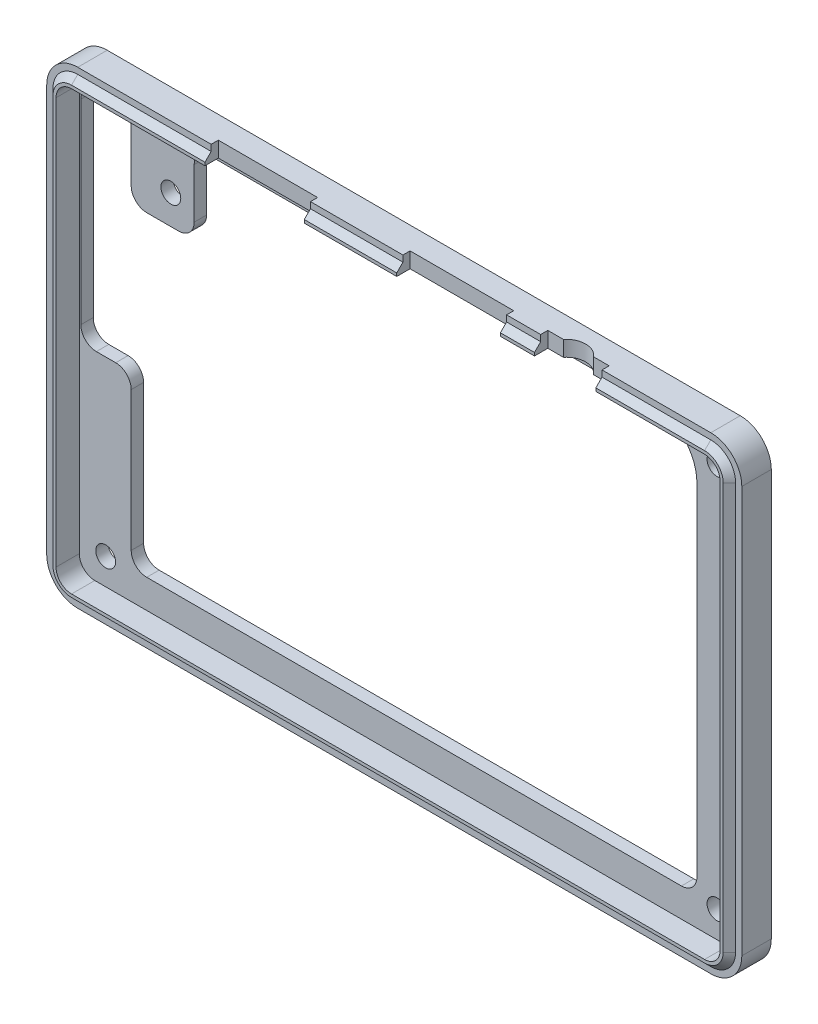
SolidWorks part; units mm, degrees
ref_plane "Front Plane" through (0, 0, 0) normal (0, 0, 1) x (1, 0, 0)
ref_plane "Top Plane" through (0, 0, 0) normal (0, 1, 0) x (1, 0, 0)
ref_plane "Right Plane" through (0, 0, 0) normal (1, 0, 0) x (0, 0, -1)
sketch "Model" plane through (0, 0, 0) normal (0, 0, 1) x (1, 0, 0)
  line L0 (0, 67.46) -> (0, 2.54)
  line L1 (2.54, 0) -> (103.96, 0)
  line L2 (106.5, 2.54) -> (106.5, 67.46)
  line L3 (103.96, 70) -> (2.54, 70)
  line L4 (82.3355, 61.0275) -> (75.5483, 71.0918) construction
  line L14 (88.4517, 60.2937) -> (88.4517, 71.0918)
  line L15 (88.4517, 71.0918) -> (85.0749, 71.0918)
  line L16 (75.5483, 60.2937) -> (75.5483, 71.0918)
  line L17 (75.5483, 60.2937) -> (88.4517, 60.2937)
  line L18 (88.4517, 71.0918) -> (81.6645, 61.0275) construction
  line L19 (78.3969, 71.0918) -> (75.5483, 71.0918)
  line L21 (85.0749, 71.0918) -> (85.0749, 71.9406)
  line L22 (85.0749, 71.9406) -> (78.3969, 71.9406)
  line L23 (78.3969, 71.0918) -> (78.3969, 71.9406)
  line L24 (0, 35) -> (106.5, 35)
  line L25 (48.4128, 61.5045) -> (42.3756, 61.5045)
  line L26 (48.4128, 61.5045) -> (48.4128, 67.5417)
  line L27 (48.4128, 67.5417) -> (42.3756, 67.5417)
  line L28 (42.3756, 61.5045) -> (42.3756, 67.5417)
  line L29 (48.4128, 61.5045) -> (42.3756, 67.5417) construction
  line L30 (48.4128, 67.5417) -> (42.3756, 61.5045) construction
  line L31 (53.25, 70) -> (53.25, 0)
  line L383 (40.4492, 62.5508) -> (39.2798, 62.5508)
  line L384 (39.2798, 62.5508) -> (39.2798, 63.1355)
  line L385 (39.2798, 63.1355) -> (39.4747, 63.3304)
  line L386 (39.4747, 63.3304) -> (39.8645, 63.3304)
  line L387 (39.8645, 63.3304) -> (40.0594, 63.1355)
  line L388 (40.0594, 63.1355) -> (40.0594, 62.5508)
  line L389 (40.0594, 62.9406) -> (40.4492, 63.3304)
  line L390 (39.2798, 64.4998) -> (39.2798, 63.7202)
  line L391 (39.2798, 63.7202) -> (40.4492, 63.7202)
  line L392 (40.4492, 63.7202) -> (40.4492, 64.4998)
  line L393 (39.8645, 63.7202) -> (39.8645, 64.11)
  line L394 (39.4747, 65.6692) -> (39.2798, 65.4743)
  line L395 (39.2798, 65.4743) -> (39.2798, 65.0845)
  line L396 (39.2798, 65.0845) -> (39.4747, 64.8896)
  line L397 (39.4747, 64.8896) -> (39.6696, 64.8896)
  line L398 (39.6696, 64.8896) -> (39.8645, 65.0845)
  line L399 (39.8645, 65.0845) -> (39.8645, 65.4743)
  line L400 (39.8645, 65.4743) -> (40.0594, 65.6692)
  line L401 (40.0594, 65.6692) -> (40.2543, 65.6692)
  line L402 (40.2543, 65.6692) -> (40.4492, 65.4743)
  line L403 (40.4492, 65.4743) -> (40.4492, 65.0845)
  line L404 (40.4492, 65.0845) -> (40.2543, 64.8896)
  line L405 (39.2798, 66.8386) -> (39.2798, 66.059)
  line L406 (39.2798, 66.059) -> (40.4492, 66.059)
  line L407 (40.4492, 66.059) -> (40.4492, 66.8386)
  line L408 (39.8645, 66.059) -> (39.8645, 66.4488)
  line L409 (40.4492, 67.6182) -> (39.2798, 67.6182)
  line L410 (39.2798, 67.2284) -> (39.2798, 68.008)
  line L411 (28.1603, 66.5296) -> (28.0375, 66.4067)
  line L412 (28.0375, 66.4067) -> (28.0375, 66.161)
  line L413 (28.0375, 66.161) -> (28.1603, 66.0381)
  line L414 (28.1603, 66.0381) -> (28.6518, 66.0381)
  line L415 (28.6518, 66.0381) -> (28.7747, 66.161)
  line L416 (28.7747, 66.161) -> (28.7747, 66.4067)
  line L417 (28.7747, 66.4067) -> (28.6518, 66.5296)
  line L418 (28.6518, 66.5296) -> (28.4061, 66.5296)
  line L419 (28.4061, 66.5296) -> (28.4061, 66.2838)
  line L420 (28.7747, 66.7865) -> (28.0375, 66.7865)
  line L421 (28.0375, 66.7865) -> (28.7747, 67.278)
  line L422 (28.7747, 67.278) -> (28.0375, 67.278)
  line L423 (28.0375, 67.5349) -> (28.7747, 67.5349)
  line L424 (28.7747, 67.5349) -> (28.7747, 67.9035)
  line L425 (28.7747, 67.9035) -> (28.6518, 68.0264)
  line L426 (28.6518, 68.0264) -> (28.1603, 68.0264)
  line L427 (28.1603, 68.0264) -> (28.0375, 67.9035)
  line L428 (28.0375, 67.9035) -> (28.0375, 67.5349)
  line L429 (30.4759, 66.0381) -> (30.9674, 66.0381)
  line L430 (30.9674, 66.0381) -> (31.2131, 66.2838)
  line L431 (31.2131, 66.2838) -> (30.9674, 66.5296)
  line L432 (30.9674, 66.5296) -> (30.4759, 66.5296)
  line L433 (30.5987, 67.278) -> (30.4759, 67.1551)
  line L434 (30.4759, 67.1551) -> (30.4759, 66.9094)
  line L435 (30.4759, 66.9094) -> (30.5987, 66.7865)
  line L436 (30.5987, 66.7865) -> (31.0902, 66.7865)
  line L437 (31.0902, 66.7865) -> (31.2131, 66.9094)
  line L438 (31.2131, 66.9094) -> (31.2131, 67.1551)
  line L439 (31.2131, 67.1551) -> (31.0902, 67.278)
  line L440 (30.5987, 68.0264) -> (30.4759, 67.9035)
  line L441 (30.4759, 67.9035) -> (30.4759, 67.6578)
  line L442 (30.4759, 67.6578) -> (30.5987, 67.5349)
  line L443 (30.5987, 67.5349) -> (31.0902, 67.5349)
  line L444 (31.0902, 67.5349) -> (31.2131, 67.6578)
  line L445 (31.2131, 67.6578) -> (31.2131, 67.9035)
  line L446 (31.2131, 67.9035) -> (31.0902, 68.0264)
  line L447 (33.0371, 66.5296) -> (32.9143, 66.4067)
  line L448 (32.9143, 66.4067) -> (32.9143, 66.161)
  line L449 (32.9143, 66.161) -> (33.0371, 66.0381)
  line L450 (33.0371, 66.0381) -> (33.16, 66.0381)
  line L451 (33.16, 66.0381) -> (33.2829, 66.161)
  line L452 (33.2829, 66.161) -> (33.2829, 66.4067)
  line L453 (33.2829, 66.4067) -> (33.4058, 66.5296)
  line L454 (33.4058, 66.5296) -> (33.5286, 66.5296)
  line L455 (33.5286, 66.5296) -> (33.6515, 66.4067)
  line L456 (33.6515, 66.4067) -> (33.6515, 66.161)
  line L457 (33.6515, 66.161) -> (33.5286, 66.0381)
  line L458 (32.9143, 66.7865) -> (33.6515, 66.7865)
  line L459 (33.6515, 66.7865) -> (33.6515, 67.1551)
  line L460 (33.6515, 67.1551) -> (33.5286, 67.278)
  line L461 (33.5286, 67.278) -> (33.0371, 67.278)
  line L462 (33.0371, 67.278) -> (32.9143, 67.1551)
  line L463 (32.9143, 67.1551) -> (32.9143, 66.7865)
  line L464 (33.6515, 67.5349) -> (33.16, 67.5349)
  line L465 (33.16, 67.5349) -> (32.9143, 67.7807)
  line L466 (32.9143, 67.7807) -> (33.16, 68.0264)
  line L467 (33.16, 68.0264) -> (33.6515, 68.0264)
  line L468 (33.2829, 67.5349) -> (33.2829, 68.0264)
  line L469 (35.4755, 66.5296) -> (35.3527, 66.4067)
  line L470 (35.3527, 66.4067) -> (35.3527, 66.161)
  line L471 (35.3527, 66.161) -> (35.4755, 66.0381)
  line L472 (35.4755, 66.0381) -> (35.5984, 66.0381)
  line L473 (35.5984, 66.0381) -> (35.7213, 66.161)
  line L474 (35.7213, 66.161) -> (35.7213, 66.4067)
  line L475 (35.7213, 66.4067) -> (35.8442, 66.5296)
  line L476 (35.8442, 66.5296) -> (35.967, 66.5296)
  line L477 (35.967, 66.5296) -> (36.0899, 66.4067)
  line L478 (36.0899, 66.4067) -> (36.0899, 66.161)
  line L479 (36.0899, 66.161) -> (35.967, 66.0381)
  line L480 (35.4755, 67.278) -> (35.3527, 67.1551)
  line L481 (35.3527, 67.1551) -> (35.3527, 66.9094)
  line L482 (35.3527, 66.9094) -> (35.4755, 66.7865)
  line L483 (35.4755, 66.7865) -> (35.967, 66.7865)
  line L484 (35.967, 66.7865) -> (36.0899, 66.9094)
  line L485 (36.0899, 66.9094) -> (36.0899, 67.1551)
  line L486 (36.0899, 67.1551) -> (35.967, 67.278)
  line L487 (35.3527, 67.5349) -> (36.0899, 67.5349)
  line L488 (36.0899, 67.5349) -> (36.0899, 68.0264)
  line L525 (5.5, 66.5) -> (23.28, 66.5)
  line L526 (23.28, 66.5) -> (23.28, 33.48)
  line L527 (23.28, 33.48) -> (5.5, 33.48)
  line L528 (5.5, 33.48) -> (5.5, 66.5)
  line L1192 (71.35, 68.8985) -> (54.65, 68.8985)
  line L1193 (71.35, 61.1) -> (54.65, 61.1)
  line L1194 (71.35, 68.8985) -> (71.35, 61.1)
  line L1195 (54.65, 68.8985) -> (54.65, 61.1)
  line L1214 (26.38, 59.89) -> (41.62, 59.89)
  line L1215 (42.89, 58.62) -> (42.89, 43.38)
  line L1216 (41.62, 42.11) -> (26.38, 42.11)
  line L1217 (25.11, 43.38) -> (25.11, 58.62)
  line L1241 (45.38, 59.89) -> (60.62, 59.89)
  line L1242 (61.89, 58.62) -> (61.89, 43.38)
  line L1243 (60.62, 42.11) -> (45.38, 42.11)
  line L1244 (44.11, 43.38) -> (44.11, 58.62)
  line L1271 (64.38, 59.89) -> (79.62, 59.89)
  line L1272 (80.89, 58.62) -> (80.89, 43.38)
  line L1273 (79.62, 42.11) -> (64.38, 42.11)
  line L1274 (63.11, 43.38) -> (63.11, 58.62)
  line L1306 (83.38, 59.89) -> (98.62, 59.89)
  line L1307 (99.89, 58.62) -> (99.89, 43.38)
  line L1308 (98.62, 42.11) -> (83.38, 42.11)
  line L1309 (82.11, 43.38) -> (82.11, 58.62)
  line L1333 (26.38, 40.89) -> (41.62, 40.89)
  line L1334 (42.89, 39.62) -> (42.89, 24.38)
  line L1335 (41.62, 23.11) -> (26.38, 23.11)
  line L1336 (25.11, 24.38) -> (25.11, 39.62)
  line L1366 (45.38, 40.89) -> (60.62, 40.89)
  line L1367 (61.89, 39.62) -> (61.89, 24.38)
  line L1368 (60.62, 23.11) -> (45.38, 23.11)
  line L1369 (44.11, 24.38) -> (44.11, 39.62)
  line L1399 (64.38, 40.89) -> (79.62, 40.89)
  line L1400 (80.89, 39.62) -> (80.89, 24.38)
  line L1401 (79.62, 23.11) -> (64.38, 23.11)
  line L1402 (63.11, 24.38) -> (63.11, 39.62)
  line L1427 (83.38, 40.89) -> (98.62, 40.89)
  line L1428 (99.89, 39.62) -> (99.89, 24.38)
  line L1429 (98.62, 23.11) -> (83.38, 23.11)
  line L1430 (82.11, 24.38) -> (82.11, 39.62)
  line L1466 (26.38, 21.89) -> (41.62, 21.89)
  line L1467 (42.89, 20.62) -> (42.89, 5.38)
  line L1468 (41.62, 4.11) -> (26.38, 4.11)
  line L1469 (25.11, 5.38) -> (25.11, 20.62)
  line L1522 (45.38, 21.89) -> (60.62, 21.89)
  line L1523 (61.89, 20.62) -> (61.89, 5.38)
  line L1524 (60.62, 4.11) -> (45.38, 4.11)
  line L1525 (44.11, 5.38) -> (44.11, 20.62)
  line L1558 (64.38, 21.89) -> (79.62, 21.89)
  line L1559 (80.89, 20.62) -> (80.89, 5.38)
  line L1560 (79.62, 4.11) -> (64.38, 4.11)
  line L1561 (63.11, 5.38) -> (63.11, 20.62)
  line L1588 (83.38, 21.89) -> (98.62, 21.89)
  line L1589 (99.89, 20.62) -> (99.89, 5.38)
  line L1590 (98.62, 4.11) -> (83.38, 4.11)
  line L1591 (82.11, 5.38) -> (82.11, 20.62)
  line L1621 (7.38, 21.89) -> (22.62, 21.89)
  line L1622 (23.89, 20.62) -> (23.89, 5.38)
  line L1623 (22.62, 4.11) -> (7.38, 4.11)
  line L1624 (6.11, 5.38) -> (6.11, 20.62)
  arc A0 (0, 2.54) -> (2.54, 0) centre (2.54, 2.54) ccw
  arc A1 (103.96, 0) -> (106.5, 2.54) centre (103.96, 2.54) ccw
  arc A2 (106.5, 67.46) -> (103.96, 70) centre (103.96, 67.46) ccw
  arc A3 (2.54, 70) -> (0, 67.46) centre (2.54, 67.46) ccw
  circle A4 centre (77, 66.525) radius 0.6
  circle A5 centre (77, 69.025) radius 0.6
  circle A6 centre (87, 69.025) radius 0.6
  circle A7 centre (87, 66.525) radius 0.6
  circle A8 centre (82, 61.525) radius 0.6
  circle A9 centre (34, 51) radius 2.0002
  circle A10 centre (53, 51) radius 2.0002
  circle A11 centre (72, 51) radius 2.0002
  circle A12 centre (91, 51) radius 2.0002
  circle A13 centre (34, 32) radius 2.0002
  circle A14 centre (53, 32) radius 2.0002
  circle A15 centre (72, 32) radius 2.0002
  circle A16 centre (91, 32) radius 2.0002
  circle A17 centre (34, 13) radius 2.0002
  circle A18 centre (53, 13) radius 2.0002
  circle A19 centre (72, 13) radius 2.0002
  circle A20 centre (91, 13) radius 2.0002
  circle A21 centre (15, 13) radius 2.0002
  circle A74 centre (14.5, 60) radius 1.5
  circle A75 centre (102.5, 4) radius 1.5
  circle A76 centre (4, 4) radius 1.5
  circle A77 centre (102.5, 66) radius 1.5
  arc A836 (39.2798, 62.5762) -> (39.2798, 62.5254) centre (39.2798, 62.5508) ccw
  arc A837 (40.4492, 62.5254) -> (40.4492, 62.5762) centre (40.4492, 62.5508) ccw
  arc A838 (39.3052, 63.1355) -> (39.2544, 63.1355) centre (39.2798, 63.1355) ccw
  arc A839 (39.2544, 62.5508) -> (39.3052, 62.5508) centre (39.2798, 62.5508) ccw
  arc A840 (39.4927, 63.3124) -> (39.4567, 63.3484) centre (39.4747, 63.3304) ccw
  arc A841 (39.2618, 63.1535) -> (39.2978, 63.1175) centre (39.2798, 63.1355) ccw
  arc A842 (39.8645, 63.305) -> (39.8645, 63.3558) centre (39.8645, 63.3304) ccw
  arc A843 (39.4747, 63.3558) -> (39.4747, 63.305) centre (39.4747, 63.3304) ccw
  arc A844 (40.0414, 63.1175) -> (40.0774, 63.1535) centre (40.0594, 63.1355) ccw
  arc A845 (39.8825, 63.3484) -> (39.8465, 63.3124) centre (39.8645, 63.3304) ccw
  arc A846 (40.034, 62.5508) -> (40.0848, 62.5508) centre (40.0594, 62.5508) ccw
  arc A847 (40.0848, 63.1355) -> (40.034, 63.1355) centre (40.0594, 63.1355) ccw
  arc A848 (40.4672, 63.3124) -> (40.4312, 63.3484) centre (40.4492, 63.3304) ccw
  arc A849 (40.0414, 62.9586) -> (40.0774, 62.9226) centre (40.0594, 62.9406) ccw
  arc A850 (39.2544, 63.7202) -> (39.3052, 63.7202) centre (39.2798, 63.7202) ccw
  arc A851 (39.3052, 64.4998) -> (39.2544, 64.4998) centre (39.2798, 64.4998) ccw
  arc A852 (40.4492, 63.6948) -> (40.4492, 63.7456) centre (40.4492, 63.7202) ccw
  arc A853 (39.2798, 63.7456) -> (39.2798, 63.6948) centre (39.2798, 63.7202) ccw
  arc A854 (40.4746, 64.4998) -> (40.4238, 64.4998) centre (40.4492, 64.4998) ccw
  arc A855 (40.4238, 63.7202) -> (40.4746, 63.7202) centre (40.4492, 63.7202) ccw
  arc A856 (39.8899, 64.11) -> (39.8391, 64.11) centre (39.8645, 64.11) ccw
  arc A857 (39.8391, 63.7202) -> (39.8899, 63.7202) centre (39.8645, 63.7202) ccw
  arc A858 (39.2618, 65.4923) -> (39.2978, 65.4563) centre (39.2798, 65.4743) ccw
  arc A859 (39.4927, 65.6512) -> (39.4567, 65.6872) centre (39.4747, 65.6692) ccw
  arc A860 (39.2544, 65.0845) -> (39.3052, 65.0845) centre (39.2798, 65.0845) ccw
  arc A861 (39.3052, 65.4743) -> (39.2544, 65.4743) centre (39.2798, 65.4743) ccw
  arc A862 (39.4567, 64.8716) -> (39.4927, 64.9076) centre (39.4747, 64.8896) ccw
  arc A863 (39.2978, 65.1025) -> (39.2618, 65.0665) centre (39.2798, 65.0845) ccw
  arc A864 (39.6696, 64.8642) -> (39.6696, 64.915) centre (39.6696, 64.8896) ccw
  arc A865 (39.4747, 64.915) -> (39.4747, 64.8642) centre (39.4747, 64.8896) ccw
  arc A866 (39.8825, 65.0665) -> (39.8465, 65.1025) centre (39.8645, 65.0845) ccw
  arc A867 (39.6516, 64.9076) -> (39.6876, 64.8716) centre (39.6696, 64.8896) ccw
  arc A868 (39.8899, 65.4743) -> (39.8391, 65.4743) centre (39.8645, 65.4743) ccw
  arc A869 (39.8391, 65.0845) -> (39.8899, 65.0845) centre (39.8645, 65.0845) ccw
  arc A870 (40.0774, 65.6512) -> (40.0414, 65.6872) centre (40.0594, 65.6692) ccw
  arc A871 (39.8465, 65.4923) -> (39.8825, 65.4563) centre (39.8645, 65.4743) ccw
  arc A872 (40.2543, 65.6438) -> (40.2543, 65.6946) centre (40.2543, 65.6692) ccw
  arc A873 (40.0594, 65.6946) -> (40.0594, 65.6438) centre (40.0594, 65.6692) ccw
  arc A874 (40.4312, 65.4563) -> (40.4672, 65.4923) centre (40.4492, 65.4743) ccw
  arc A875 (40.2723, 65.6872) -> (40.2363, 65.6512) centre (40.2543, 65.6692) ccw
  arc A876 (40.4238, 65.0845) -> (40.4746, 65.0845) centre (40.4492, 65.0845) ccw
  arc A877 (40.4746, 65.4743) -> (40.4238, 65.4743) centre (40.4492, 65.4743) ccw
  arc A878 (40.2363, 64.9076) -> (40.2723, 64.8716) centre (40.2543, 64.8896) ccw
  arc A879 (40.4672, 65.0665) -> (40.4312, 65.1025) centre (40.4492, 65.0845) ccw
  arc A880 (39.2544, 66.059) -> (39.3052, 66.059) centre (39.2798, 66.059) ccw
  arc A881 (39.3052, 66.8386) -> (39.2544, 66.8386) centre (39.2798, 66.8386) ccw
  arc A882 (40.4492, 66.0336) -> (40.4492, 66.0844) centre (40.4492, 66.059) ccw
  arc A883 (39.2798, 66.0844) -> (39.2798, 66.0336) centre (39.2798, 66.059) ccw
  arc A884 (40.4746, 66.8386) -> (40.4238, 66.8386) centre (40.4492, 66.8386) ccw
  arc A885 (40.4238, 66.059) -> (40.4746, 66.059) centre (40.4492, 66.059) ccw
  arc A886 (39.8899, 66.4488) -> (39.8391, 66.4488) centre (39.8645, 66.4488) ccw
  arc A887 (39.8391, 66.059) -> (39.8899, 66.059) centre (39.8645, 66.059) ccw
  arc A888 (39.2798, 67.6436) -> (39.2798, 67.5928) centre (39.2798, 67.6182) ccw
  arc A889 (40.4492, 67.5928) -> (40.4492, 67.6436) centre (40.4492, 67.6182) ccw
  arc A890 (39.3052, 68.008) -> (39.2544, 68.008) centre (39.2798, 68.008) ccw
  arc A891 (39.2544, 67.2284) -> (39.3052, 67.2284) centre (39.2798, 67.2284) ccw
  arc A892 (28.024, 66.4202) -> (28.0509, 66.3932) centre (28.0374, 66.4067) ccw
  arc A893 (28.1738, 66.5161) -> (28.1469, 66.5431) centre (28.1604, 66.5296) ccw
  arc A894 (28.0184, 66.161) -> (28.0565, 66.161) centre (28.0374, 66.161) ccw
  arc A895 (28.0565, 66.4067) -> (28.0184, 66.4067) centre (28.0374, 66.4067) ccw
  arc A896 (28.1469, 66.0246) -> (28.1738, 66.0516) centre (28.1604, 66.0381) ccw
  arc A897 (28.0509, 66.1744) -> (28.024, 66.1475) centre (28.0374, 66.1609) ccw
  arc A898 (28.6518, 66.0191) -> (28.6518, 66.0571) centre (28.6518, 66.0381) ccw
  arc A899 (28.1603, 66.0571) -> (28.1603, 66.0191) centre (28.1603, 66.0381) ccw
  arc A900 (28.7882, 66.1475) -> (28.7612, 66.1744) centre (28.7747, 66.1609) ccw
  arc A901 (28.6384, 66.0516) -> (28.6653, 66.0246) centre (28.6518, 66.0381) ccw
  arc A902 (28.7938, 66.4067) -> (28.7557, 66.4067) centre (28.7748, 66.4067) ccw
  arc A903 (28.7557, 66.161) -> (28.7938, 66.161) centre (28.7748, 66.161) ccw
  arc A904 (28.6653, 66.5431) -> (28.6384, 66.5161) centre (28.6518, 66.5296) ccw
  arc A905 (28.7612, 66.3932) -> (28.7882, 66.4202) centre (28.7747, 66.4067) ccw
  arc A906 (28.4061, 66.5486) -> (28.4061, 66.5105) centre (28.4061, 66.5295) ccw
  arc A907 (28.6518, 66.5105) -> (28.6518, 66.5486) centre (28.6518, 66.5295) ccw
  arc A908 (28.387, 66.2838) -> (28.4251, 66.2838) centre (28.4061, 66.2838) ccw
  arc A909 (28.4251, 66.5296) -> (28.387, 66.5296) centre (28.4061, 66.5296) ccw
  arc A910 (28.0375, 66.8056) -> (28.0375, 66.7675) centre (28.0375, 66.7866) ccw
  arc A911 (28.7747, 66.7675) -> (28.7747, 66.8056) centre (28.7747, 66.7866) ccw
  arc A912 (28.7853, 67.2621) -> (28.7641, 67.2939) centre (28.7747, 67.278) ccw
  arc A913 (28.0269, 66.8024) -> (28.048, 66.7707) centre (28.0374, 66.7866) ccw
  arc A914 (28.0375, 67.297) -> (28.0375, 67.259) centre (28.0375, 67.278) ccw
  arc A915 (28.7747, 67.259) -> (28.7747, 67.297) centre (28.7747, 67.278) ccw
  arc A916 (28.7747, 67.5159) -> (28.7747, 67.554) centre (28.7747, 67.535) ccw
  arc A917 (28.0375, 67.554) -> (28.0375, 67.5159) centre (28.0375, 67.535) ccw
  arc A918 (28.7938, 67.9035) -> (28.7557, 67.9035) centre (28.7748, 67.9035) ccw
  arc A919 (28.7557, 67.5349) -> (28.7938, 67.5349) centre (28.7748, 67.5349) ccw
  arc A920 (28.6653, 68.0399) -> (28.6384, 68.0129) centre (28.6518, 68.0264) ccw
  arc A921 (28.7612, 67.8901) -> (28.7882, 67.917) centre (28.7747, 67.9036) ccw
  arc A922 (28.1603, 68.0455) -> (28.1603, 68.0074) centre (28.1603, 68.0265) ccw
  arc A923 (28.6518, 68.0074) -> (28.6518, 68.0455) centre (28.6518, 68.0265) ccw
  arc A924 (28.024, 67.917) -> (28.0509, 67.8901) centre (28.0374, 67.9036) ccw
  arc A925 (28.1738, 68.0129) -> (28.1469, 68.0399) centre (28.1604, 68.0264) ccw
  arc A926 (28.0184, 67.5349) -> (28.0565, 67.5349) centre (28.0374, 67.5349) ccw
  arc A927 (28.0565, 67.9035) -> (28.0184, 67.9035) centre (28.0374, 67.9035) ccw
  arc A928 (30.9674, 66.0191) -> (30.9674, 66.0571) centre (30.9674, 66.0381) ccw
  arc A929 (30.4759, 66.0571) -> (30.4759, 66.0191) centre (30.4759, 66.0381) ccw
  arc A930 (31.2266, 66.2704) -> (31.1996, 66.2973) centre (31.2131, 66.2839) ccw
  arc A931 (30.9539, 66.0516) -> (30.9808, 66.0246) centre (30.9673, 66.0381) ccw
  arc A932 (30.9808, 66.5431) -> (30.9539, 66.5161) centre (30.9673, 66.5296) ccw
  arc A933 (31.1996, 66.2704) -> (31.2266, 66.2973) centre (31.2131, 66.2839) ccw
  arc A934 (30.4759, 66.5486) -> (30.4759, 66.5105) centre (30.4759, 66.5295) ccw
  arc A935 (30.9674, 66.5105) -> (30.9674, 66.5486) centre (30.9674, 66.5295) ccw
  arc A936 (30.4624, 67.1686) -> (30.4893, 67.1417) centre (30.4758, 67.1551) ccw
  arc A937 (30.6122, 67.2645) -> (30.5853, 67.2915) centre (30.5988, 67.278) ccw
  arc A938 (30.4568, 66.9094) -> (30.4949, 66.9094) centre (30.4759, 66.9094) ccw
  arc A939 (30.4949, 67.1551) -> (30.4568, 67.1551) centre (30.4759, 67.1551) ccw
  arc A940 (30.5853, 66.773) -> (30.6122, 66.8) centre (30.5988, 66.7865) ccw
  arc A941 (30.4893, 66.9229) -> (30.4624, 66.8959) centre (30.4759, 66.9094) ccw
  arc A942 (31.0902, 66.7675) -> (31.0902, 66.8056) centre (31.0902, 66.7866) ccw
  arc A943 (30.5987, 66.8056) -> (30.5987, 66.7675) centre (30.5987, 66.7866) ccw
  arc A944 (31.2266, 66.8959) -> (31.1996, 66.9229) centre (31.2131, 66.9094) ccw
  arc A945 (31.0768, 66.8) -> (31.1037, 66.773) centre (31.0903, 66.7865) ccw
  arc A946 (31.2322, 67.1551) -> (31.1941, 67.1551) centre (31.2131, 67.1551) ccw
  arc A947 (31.1941, 66.9094) -> (31.2322, 66.9094) centre (31.2131, 66.9094) ccw
  arc A948 (31.1037, 67.2915) -> (31.0768, 67.2645) centre (31.0903, 67.278) ccw
  arc A949 (31.1996, 67.1417) -> (31.2266, 67.1686) centre (31.2131, 67.1551) ccw
  arc A950 (30.4624, 67.917) -> (30.4893, 67.8901) centre (30.4758, 67.9036) ccw
  arc A951 (30.6122, 68.0129) -> (30.5853, 68.0399) centre (30.5988, 68.0264) ccw
  arc A952 (30.4568, 67.6578) -> (30.4949, 67.6578) centre (30.4759, 67.6578) ccw
  arc A953 (30.4949, 67.9035) -> (30.4568, 67.9035) centre (30.4759, 67.9035) ccw
  arc A954 (30.5853, 67.5215) -> (30.6122, 67.5484) centre (30.5988, 67.535) ccw
  arc A955 (30.4893, 67.6713) -> (30.4624, 67.6443) centre (30.4759, 67.6578) ccw
  arc A956 (31.0902, 67.5159) -> (31.0902, 67.554) centre (31.0902, 67.535) ccw
  arc A957 (30.5987, 67.554) -> (30.5987, 67.5159) centre (30.5987, 67.535) ccw
  arc A958 (31.2266, 67.6443) -> (31.1996, 67.6713) centre (31.2131, 67.6578) ccw
  arc A959 (31.0768, 67.5484) -> (31.1037, 67.5215) centre (31.0903, 67.535) ccw
  arc A960 (31.2322, 67.9035) -> (31.1941, 67.9035) centre (31.2131, 67.9035) ccw
  arc A961 (31.1941, 67.6578) -> (31.2322, 67.6578) centre (31.2131, 67.6578) ccw
  arc A962 (31.1037, 68.0399) -> (31.0768, 68.0129) centre (31.0903, 68.0264) ccw
  arc A963 (31.1996, 67.8901) -> (31.2266, 67.917) centre (31.2131, 67.9036) ccw
  arc A964 (32.9008, 66.4202) -> (32.9277, 66.3932) centre (32.9142, 66.4067) ccw
  arc A965 (33.0506, 66.5161) -> (33.0237, 66.5431) centre (33.0372, 66.5296) ccw
  arc A966 (32.8952, 66.161) -> (32.9333, 66.161) centre (32.9143, 66.161) ccw
  arc A967 (32.9333, 66.4067) -> (32.8952, 66.4067) centre (32.9142, 66.4067) ccw
  arc A968 (33.0237, 66.0246) -> (33.0506, 66.0516) centre (33.0372, 66.0381) ccw
  arc A969 (32.9277, 66.1744) -> (32.9008, 66.1475) centre (32.9142, 66.1609) ccw
  arc A970 (33.16, 66.0191) -> (33.16, 66.0571) centre (33.16, 66.0381) ccw
  arc A971 (33.0371, 66.0571) -> (33.0371, 66.0191) centre (33.0371, 66.0381) ccw
  arc A972 (33.2964, 66.1475) -> (33.2694, 66.1744) centre (33.2829, 66.1609) ccw
  arc A973 (33.1465, 66.0516) -> (33.1735, 66.0246) centre (33.16, 66.0381) ccw
  arc A974 (33.3019, 66.4067) -> (33.2638, 66.4067) centre (33.2829, 66.4067) ccw
  arc A975 (33.2638, 66.161) -> (33.3019, 66.161) centre (33.2829, 66.161) ccw
  arc A976 (33.4192, 66.5161) -> (33.3923, 66.5431) centre (33.4057, 66.5296) ccw
  arc A977 (33.2694, 66.4202) -> (33.2964, 66.3932) centre (33.2829, 66.4067) ccw
  arc A978 (33.5286, 66.5105) -> (33.5286, 66.5486) centre (33.5286, 66.5295) ccw
  arc A979 (33.4058, 66.5486) -> (33.4058, 66.5105) centre (33.4058, 66.5295) ccw
  arc A980 (33.638, 66.3932) -> (33.665, 66.4202) centre (33.6515, 66.4067) ccw
  arc A981 (33.5421, 66.5431) -> (33.5152, 66.5161) centre (33.5286, 66.5296) ccw
  arc A982 (33.6324, 66.161) -> (33.6705, 66.161) centre (33.6514, 66.161) ccw
  arc A983 (33.6705, 66.4067) -> (33.6324, 66.4067) centre (33.6514, 66.4067) ccw
  arc A984 (33.5152, 66.0516) -> (33.5421, 66.0246) centre (33.5286, 66.0381) ccw
  arc A985 (33.665, 66.1475) -> (33.638, 66.1744) centre (33.6515, 66.1609) ccw
  arc A986 (33.6515, 66.7675) -> (33.6515, 66.8056) centre (33.6515, 66.7866) ccw
  arc A987 (32.9143, 66.8056) -> (32.9143, 66.7675) centre (32.9143, 66.7866) ccw
  arc A988 (33.6705, 67.1551) -> (33.6324, 67.1551) centre (33.6514, 67.1551) ccw
  arc A989 (33.6324, 66.7865) -> (33.6705, 66.7865) centre (33.6514, 66.7865) ccw
  arc A990 (33.5421, 67.2915) -> (33.5152, 67.2645) centre (33.5286, 67.278) ccw
  arc A991 (33.638, 67.1417) -> (33.665, 67.1686) centre (33.6515, 67.1551) ccw
  arc A992 (33.0371, 67.297) -> (33.0371, 67.259) centre (33.0371, 67.278) ccw
  arc A993 (33.5286, 67.259) -> (33.5286, 67.297) centre (33.5286, 67.278) ccw
  arc A994 (32.9008, 67.1686) -> (32.9277, 67.1417) centre (32.9142, 67.1551) ccw
  arc A995 (33.0506, 67.2645) -> (33.0237, 67.2915) centre (33.0372, 67.278) ccw
  arc A996 (32.8952, 66.7865) -> (32.9333, 66.7865) centre (32.9143, 66.7865) ccw
  arc A997 (32.9333, 67.1551) -> (32.8952, 67.1551) centre (32.9143, 67.1551) ccw
  arc A998 (33.16, 67.554) -> (33.16, 67.5159) centre (33.16, 67.535) ccw
  arc A999 (33.6515, 67.5159) -> (33.6515, 67.554) centre (33.6515, 67.535) ccw
  arc A1000 (32.9277, 67.7941) -> (32.9008, 67.7672) centre (32.9142, 67.7806) ccw
  arc A1001 (33.1465, 67.5215) -> (33.1735, 67.5484) centre (33.16, 67.535) ccw
  arc A1002 (33.1735, 68.0129) -> (33.1465, 68.0399) centre (33.16, 68.0264) ccw
  arc A1003 (32.9008, 67.7941) -> (32.9277, 67.7672) centre (32.9142, 67.7806) ccw
  arc A1004 (33.6515, 68.0074) -> (33.6515, 68.0455) centre (33.6515, 68.0265) ccw
  arc A1005 (33.16, 68.0455) -> (33.16, 68.0074) centre (33.16, 68.0265) ccw
  arc A1006 (33.3019, 68.0264) -> (33.2638, 68.0264) centre (33.2829, 68.0264) ccw
  arc A1007 (33.2638, 67.5349) -> (33.3019, 67.5349) centre (33.2829, 67.5349) ccw
  arc A1008 (35.3392, 66.4202) -> (35.3661, 66.3932) centre (35.3526, 66.4067) ccw
  arc A1009 (35.489, 66.5161) -> (35.4621, 66.5431) centre (35.4755, 66.5296) ccw
  arc A1010 (35.3336, 66.161) -> (35.3717, 66.161) centre (35.3526, 66.161) ccw
  arc A1011 (35.3717, 66.4067) -> (35.3336, 66.4067) centre (35.3526, 66.4067) ccw
  arc A1012 (35.4621, 66.0246) -> (35.489, 66.0516) centre (35.4755, 66.0381) ccw
  arc A1013 (35.3661, 66.1744) -> (35.3392, 66.1475) centre (35.3526, 66.1609) ccw
  arc A1014 (35.5984, 66.0191) -> (35.5984, 66.0571) centre (35.5984, 66.0381) ccw
  arc A1015 (35.4755, 66.0571) -> (35.4755, 66.0191) centre (35.4755, 66.0381) ccw
  arc A1016 (35.7348, 66.1475) -> (35.7078, 66.1744) centre (35.7213, 66.1609) ccw
  arc A1017 (35.5849, 66.0516) -> (35.6119, 66.0246) centre (35.5984, 66.0381) ccw
  arc A1018 (35.7403, 66.4067) -> (35.7022, 66.4067) centre (35.7212, 66.4067) ccw
  arc A1019 (35.7022, 66.161) -> (35.7403, 66.161) centre (35.7212, 66.161) ccw
  arc A1020 (35.8576, 66.5161) -> (35.8307, 66.5431) centre (35.8441, 66.5296) ccw
  arc A1021 (35.7078, 66.4202) -> (35.7348, 66.3932) centre (35.7213, 66.4067) ccw
  arc A1022 (35.967, 66.5105) -> (35.967, 66.5486) centre (35.967, 66.5295) ccw
  arc A1023 (35.8442, 66.5486) -> (35.8442, 66.5105) centre (35.8442, 66.5295) ccw
  arc A1024 (36.0764, 66.3932) -> (36.1034, 66.4202) centre (36.0899, 66.4067) ccw
  arc A1025 (35.9805, 66.5431) -> (35.9536, 66.5161) centre (35.9671, 66.5296) ccw
  arc A1026 (36.0709, 66.161) -> (36.109, 66.161) centre (36.09, 66.161) ccw
  arc A1027 (36.109, 66.4067) -> (36.0709, 66.4067) centre (36.09, 66.4067) ccw
  arc A1028 (35.9536, 66.0516) -> (35.9805, 66.0246) centre (35.9671, 66.0381) ccw
  arc A1029 (36.1034, 66.1475) -> (36.0764, 66.1744) centre (36.0899, 66.1609) ccw
  arc A1030 (35.3392, 67.1686) -> (35.3661, 67.1417) centre (35.3526, 67.1551) ccw
  arc A1031 (35.489, 67.2645) -> (35.4621, 67.2915) centre (35.4755, 67.278) ccw
  arc A1032 (35.3336, 66.9094) -> (35.3717, 66.9094) centre (35.3526, 66.9094) ccw
  arc A1033 (35.3717, 67.1551) -> (35.3336, 67.1551) centre (35.3526, 67.1551) ccw
  arc A1034 (35.4621, 66.773) -> (35.489, 66.8) centre (35.4755, 66.7865) ccw
  arc A1035 (35.3661, 66.9229) -> (35.3392, 66.8959) centre (35.3526, 66.9094) ccw
  arc A1036 (35.967, 66.7675) -> (35.967, 66.8056) centre (35.967, 66.7866) ccw
  arc A1037 (35.4755, 66.8056) -> (35.4755, 66.7675) centre (35.4755, 66.7866) ccw
  arc A1038 (36.1034, 66.8959) -> (36.0764, 66.9229) centre (36.0899, 66.9094) ccw
  arc A1039 (35.9536, 66.8) -> (35.9805, 66.773) centre (35.9671, 66.7865) ccw
  arc A1040 (36.109, 67.1551) -> (36.0709, 67.1551) centre (36.09, 67.1551) ccw
  arc A1041 (36.0709, 66.9094) -> (36.109, 66.9094) centre (36.09, 66.9094) ccw
  arc A1042 (35.9805, 67.2915) -> (35.9536, 67.2645) centre (35.9671, 67.278) ccw
  arc A1043 (36.0764, 67.1417) -> (36.1034, 67.1686) centre (36.0899, 67.1551) ccw
  arc A1044 (36.0899, 67.5159) -> (36.0899, 67.554) centre (36.0899, 67.535) ccw
  arc A1045 (35.3527, 67.554) -> (35.3527, 67.5159) centre (35.3527, 67.535) ccw
  arc A1046 (36.109, 68.0264) -> (36.0709, 68.0264) centre (36.09, 68.0264) ccw
  arc A1047 (36.0709, 67.5349) -> (36.109, 67.5349) centre (36.09, 67.5349) ccw
  arc A1120 (23.28, 66.4682) -> (23.28, 66.5318) centre (23.28, 66.5) ccw
  arc A1121 (5.5, 66.5318) -> (5.5, 66.4682) centre (5.5, 66.5) ccw
  arc A1122 (23.2483, 33.48) -> (23.3117, 33.48) centre (23.28, 33.48) ccw
  arc A1123 (23.3117, 66.5) -> (23.2483, 66.5) centre (23.28, 66.5) ccw
  arc A1124 (5.5, 33.5118) -> (5.5, 33.4483) centre (5.5, 33.4801) ccw
  arc A1125 (23.28, 33.4483) -> (23.28, 33.5118) centre (23.28, 33.4801) ccw
  arc A1126 (5.5317, 66.5) -> (5.4683, 66.5) centre (5.5, 66.5) ccw
  arc A1127 (5.4683, 33.48) -> (5.5317, 33.48) centre (5.5, 33.48) ccw
  arc A2454 (54.65, 68.9493) -> (54.65, 68.8477) centre (54.65, 68.8985) ccw
  arc A2455 (71.35, 68.8477) -> (71.35, 68.9493) centre (71.35, 68.8985) ccw
  arc A2456 (54.65, 61.1508) -> (54.65, 61.0492) centre (54.65, 61.1) ccw
  arc A2457 (71.35, 61.0492) -> (71.35, 61.1508) centre (71.35, 61.1) ccw
  arc A2458 (71.2992, 61.1) -> (71.4008, 61.1) centre (71.35, 61.1) ccw
  arc A2459 (71.4008, 68.8985) -> (71.2992, 68.8985) centre (71.35, 68.8985) ccw
  arc A2460 (54.5992, 61.1) -> (54.7008, 61.1) centre (54.65, 61.1) ccw
  arc A2461 (54.7008, 68.8985) -> (54.5992, 68.8985) centre (54.65, 68.8985) ccw
  arc A2500 (42.89, 58.62) -> (41.62, 59.89) centre (41.62, 58.62) ccw
  arc A2505 (41.62, 42.11) -> (42.89, 43.38) centre (41.62, 43.38) ccw
  arc A2510 (25.11, 43.38) -> (26.38, 42.11) centre (26.38, 43.38) ccw
  arc A2515 (26.38, 59.89) -> (25.11, 58.62) centre (26.38, 58.62) ccw
  arc A2566 (61.89, 58.62) -> (60.62, 59.89) centre (60.62, 58.62) ccw
  arc A2571 (60.62, 42.11) -> (61.89, 43.38) centre (60.62, 43.38) ccw
  arc A2576 (44.11, 43.38) -> (45.38, 42.11) centre (45.38, 43.38) ccw
  arc A2581 (45.38, 59.89) -> (44.11, 58.62) centre (45.38, 58.62) ccw
  arc A2638 (80.89, 58.62) -> (79.62, 59.89) centre (79.62, 58.62) ccw
  arc A2643 (79.62, 42.11) -> (80.89, 43.38) centre (79.62, 43.38) ccw
  arc A2648 (63.11, 43.38) -> (64.38, 42.11) centre (64.38, 43.38) ccw
  arc A2653 (64.38, 59.89) -> (63.11, 58.62) centre (64.38, 58.62) ccw
  arc A2720 (99.89, 58.62) -> (98.62, 59.89) centre (98.62, 58.62) ccw
  arc A2725 (98.62, 42.11) -> (99.89, 43.38) centre (98.62, 43.38) ccw
  arc A2730 (82.11, 43.38) -> (83.38, 42.11) centre (83.38, 43.38) ccw
  arc A2735 (83.38, 59.89) -> (82.11, 58.62) centre (83.38, 58.62) ccw
  arc A2786 (42.89, 39.62) -> (41.62, 40.89) centre (41.62, 39.62) ccw
  arc A2791 (41.62, 23.11) -> (42.89, 24.38) centre (41.62, 24.38) ccw
  arc A2796 (25.11, 24.38) -> (26.38, 23.11) centre (26.38, 24.38) ccw
  arc A2801 (26.38, 40.89) -> (25.11, 39.62) centre (26.38, 39.62) ccw
  arc A2864 (61.89, 39.62) -> (60.62, 40.89) centre (60.62, 39.62) ccw
  arc A2869 (60.62, 23.11) -> (61.89, 24.38) centre (60.62, 24.38) ccw
  arc A2874 (44.11, 24.38) -> (45.38, 23.11) centre (45.38, 24.38) ccw
  arc A2879 (45.38, 40.89) -> (44.11, 39.62) centre (45.38, 39.62) ccw
  arc A2942 (80.89, 39.62) -> (79.62, 40.89) centre (79.62, 39.62) ccw
  arc A2947 (79.62, 23.11) -> (80.89, 24.38) centre (79.62, 24.38) ccw
  arc A2952 (63.11, 24.38) -> (64.38, 23.11) centre (64.38, 24.38) ccw
  arc A2957 (64.38, 40.89) -> (63.11, 39.62) centre (64.38, 39.62) ccw
  arc A3010 (99.89, 39.62) -> (98.62, 40.89) centre (98.62, 39.62) ccw
  arc A3015 (98.62, 23.11) -> (99.89, 24.38) centre (98.62, 24.38) ccw
  arc A3020 (82.11, 24.38) -> (83.38, 23.11) centre (83.38, 24.38) ccw
  arc A3025 (83.38, 40.89) -> (82.11, 39.62) centre (83.38, 39.62) ccw
  arc A3100 (42.89, 20.62) -> (41.62, 21.89) centre (41.62, 20.62) ccw
  arc A3105 (41.62, 4.11) -> (42.89, 5.38) centre (41.62, 5.38) ccw
  arc A3110 (25.11, 5.38) -> (26.38, 4.11) centre (26.38, 5.38) ccw
  arc A3115 (26.38, 21.89) -> (25.11, 20.62) centre (26.38, 20.62) ccw
  arc A3224 (61.89, 20.62) -> (60.62, 21.89) centre (60.62, 20.62) ccw
  arc A3229 (60.62, 4.11) -> (61.89, 5.38) centre (60.62, 5.38) ccw
  arc A3234 (44.11, 5.38) -> (45.38, 4.11) centre (45.38, 5.38) ccw
  arc A3239 (45.38, 21.89) -> (44.11, 20.62) centre (45.38, 20.62) ccw
  arc A3308 (80.89, 20.62) -> (79.62, 21.89) centre (79.62, 20.62) ccw
  arc A3313 (79.62, 4.11) -> (80.89, 5.38) centre (79.62, 5.38) ccw
  arc A3318 (63.11, 5.38) -> (64.38, 4.11) centre (64.38, 5.38) ccw
  arc A3323 (64.38, 21.89) -> (63.11, 20.62) centre (64.38, 20.62) ccw
  arc A3380 (99.89, 20.62) -> (98.62, 21.89) centre (98.62, 20.62) ccw
  arc A3385 (98.62, 4.11) -> (99.89, 5.38) centre (98.62, 5.38) ccw
  arc A3390 (82.11, 5.38) -> (83.38, 4.11) centre (83.38, 5.38) ccw
  arc A3395 (83.38, 21.89) -> (82.11, 20.62) centre (83.38, 20.62) ccw
  arc A3458 (23.89, 20.62) -> (22.62, 21.89) centre (22.62, 20.62) ccw
  arc A3463 (22.62, 4.11) -> (23.89, 5.38) centre (22.62, 5.38) ccw
  arc A3468 (6.11, 5.38) -> (7.38, 4.11) centre (7.38, 5.38) ccw
  arc A3473 (7.38, 21.89) -> (6.11, 20.62) centre (7.38, 20.62) ccw
  circle A3860 centre (14.5, 60) radius 1.6
  circle A3861 centre (102.5, 4) radius 1.6
  circle A3862 centre (4, 4) radius 1.6
  circle A3863 centre (102.5, 66) radius 1.6
  point P52 (81.7359, 70)
  point P58 (45.3942, 64.5231)
  dimension "D1" = 106.5
  dimension "D2" = 70
sketch "Sketch2" plane through (0, 0, 0) normal (0, 0, 1) x (1, 0, 0)
  line L0 (0, 35) -> (106.5, 35) construction
  line L1 (104.25, -0.25) -> (2.25, -0.25)
  line L2 (106.75, 2.25) -> (106.75, 67.75)
  line L3 (104.25, 70.25) -> (2.25, 70.25)
  line L4 (-0.25, 2.25) -> (-0.25, 67.75)
  line L5 (106.75, -0.25) -> (-0.25, 70.25) construction
  line L6 (106.75, 70.25) -> (-0.25, -0.25) construction
  line L7 (104.25, 72.75) -> (2.25, 72.75)
  line L8 (-2.75, 2.25) -> (-2.75, 67.75)
  line L9 (104.25, -2.75) -> (2.25, -2.75)
  line L10 (109.25, 2.25) -> (109.25, 67.75)
  arc A0 (106.75, 67.75) -> (104.25, 70.25) centre (104.25, 67.75) ccw
  arc A1 (104.25, -0.25) -> (106.75, 2.25) centre (104.25, 2.25) ccw
  arc A2 (2.25, -0.25) -> (-0.25, 2.25) centre (2.25, 2.25) cw
  arc A3 (2.25, 70.25) -> (-0.25, 67.75) centre (2.25, 67.75) ccw
  arc A4 (2.25, 72.75) -> (-2.75, 67.75) centre (2.25, 67.75) ccw
  arc A5 (2.25, -2.75) -> (-2.75, 2.25) centre (2.25, 2.25) cw
  arc A6 (104.25, -2.75) -> (109.25, 2.25) centre (104.25, 2.25) ccw
  arc A7 (109.25, 67.75) -> (104.25, 72.75) centre (104.25, 67.75) ccw
  point P0 (53.25, 35)
  dimension "D3" = 2.5
  dimension "D1" = 70.5
  dimension "D2" = 107
  dimension "D4" = 2.5
extrude "Boss-Extrude1" add sketch "Sketch2" along normal blind 2.75
ref_point "Point1"
sketch "Sketch3" plane through (0, 0, 0) normal (0, 0, -1) x (-1, 0, 0)
  line L7 (-2.25, 72.75) -> (-104.25, 72.75)
  line L8 (-109.25, 2.25) -> (-109.25, 67.75)
  line L9 (-2.25, -2.75) -> (-104.25, -2.75)
  line L10 (2.75, 2.25) -> (2.75, 67.75)
  arc A4 (-104.25, 72.75) -> (-109.25, 67.75) centre (-104.25, 67.75) ccw
  arc A5 (-104.25, -2.75) -> (-109.25, 2.25) centre (-104.25, 2.25) cw
  arc A6 (-2.25, -2.75) -> (2.75, 2.25) centre (-2.25, 2.25) ccw
  arc A7 (2.75, 67.75) -> (-2.25, 72.75) centre (-2.25, 67.75) ccw
  point P0 (-53.25, 35)
extrude "Boss-Extrude2" add sketch "Sketch3" along normal blind 2
sketch "Sketch4" plane through (0, 0, 0) normal (0, 0, 1) x (1, 0, 0)
  line L0 (0, 67.46) -> (0, 2.54) construction
  line L1 (95.6319, 4.3858) -> (10.6134, 4.3858)
  line L4 (8.1134, 6.8858) -> (8.1134, 29.3234)
  line L5 (98.1319, 4.3858) -> (53.25, 35) construction
  line L6 (98.1319, 65.4414) -> (8.1134, 4.3858) construction
  line L18 (5.6134, 31.8234) -> (2.5, 31.8234)
  line L19 (8.1134, 57.7604) -> (8.1134, 65.7977)
  line L20 (5.6134, 68.2977) -> (2.5, 68.2977)
  line L21 (0, 34.3234) -> (0, 65.7977)
  line L24 (10.6134, 55.2604) -> (15.7618, 55.2604)
  line L28 (28.2785, 68.2977) -> (50.7785, 68.2977)
  line L32 (23.3866, 68.2977) -> (28.2785, 68.2977)
  line L35 (18.2618, 57.7604) -> (18.2618, 65.7977)
  line L36 (20.7618, 68.2977) -> (23.3866, 68.2977)
  line L39 (81.9624, 69.3772) -> (53.2785, 69.3772)
  line L41 (50.7785, 68.2977) -> (53.2785, 69.3772)
  line L44 (96.7673, 4.3858) -> (95.6319, 4.3858)
  line L52 (99.2673, 61.8772) -> (99.2673, 6.8858)
  line L53 (91.7673, 69.3772) -> (81.9624, 69.3772)
  arc A0 (10.6134, 4.3858) -> (8.1134, 6.8858) centre (10.6134, 6.8858) cw
  arc A11 (8.1134, 65.7977) -> (5.6134, 68.2977) centre (5.6134, 65.7977) ccw
  arc A12 (2.5, 68.2977) -> (0, 65.7977) centre (2.5, 65.7977) ccw
  arc A13 (5.6134, 31.8234) -> (8.1134, 29.3234) centre (5.6134, 29.3234) cw
  arc A14 (2.5, 31.8234) -> (0, 34.3234) centre (2.5, 34.3234) cw
  arc A18 (10.6134, 55.2604) -> (8.1134, 57.7604) centre (10.6134, 57.7604) cw
  circle A19 centre (4, 4) radius 1.6
  circle A20 centre (14.5, 60) radius 1.6
  circle A21 centre (102.5, 66) radius 1.6
  circle A22 centre (102.5, 4) radius 1.6
  arc A23 (18.2618, 65.7977) -> (20.7618, 68.2977) centre (20.7618, 65.7977) cw
  arc A24 (18.2618, 57.7604) -> (15.7618, 55.2604) centre (15.7618, 57.7604) cw
  arc A25 (99.2673, 6.8858) -> (96.7673, 4.3858) centre (96.7673, 6.8858) cw
  arc A28 (99.2673, 61.8772) -> (91.7673, 69.3772) centre (91.7673, 61.8772) ccw
  point P0 (53.25, 35)
  point P8 (14.5, 60)
  point P46 (23.3333, 64.3698)
  point P52 (71.35, 68.8985)
  point P60 (53.2785, 68.2977)
  dimension "D1" = 2.5
  dimension "D2" = 2.5
  dimension "D4" = 2.5
  dimension "D5" = 2.5
  dimension "D6" = 7.5
  dimension "D3" = 25
extrude "Cut-Extrude1" cut sketch "Sketch4" against normal blind 2
sketch "Sketch7" plane through (0, 0, 2.75) normal (0, 0, 1) x (1, 0, 0)
  line L1 (104.25, -0.25) -> (2.25, -0.25)
  line L2 (106.75, 2.25) -> (106.75, 67.75)
  line L3 (104.25, 70.25) -> (2.25, 70.25)
  line L4 (-0.25, 2.25) -> (-0.25, 67.75)
  line L5 (106.75, -0.25) -> (-0.25, 70.25) construction
  line L6 (106.75, 70.25) -> (-0.25, -0.25) construction
  line L7 (104.25, 71.75) -> (2.25, 71.75)
  line L8 (-1.75, 2.25) -> (-1.75, 67.75)
  line L9 (104.25, -1.75) -> (2.25, -1.75)
  line L10 (108.25, 2.25) -> (108.25, 67.75)
  line L11 (0, 35) -> (106.5, 35) construction
  arc A0 (106.75, 67.75) -> (104.25, 70.25) centre (104.25, 67.75) ccw
  arc A1 (104.25, -0.25) -> (106.75, 2.25) centre (104.25, 2.25) ccw
  arc A2 (2.25, -0.25) -> (-0.25, 2.25) centre (2.25, 2.25) cw
  arc A3 (2.25, 70.25) -> (-0.25, 67.75) centre (2.25, 67.75) ccw
  arc A4 (2.25, 71.75) -> (-1.75, 67.75) centre (2.25, 67.75) ccw
  arc A5 (2.25, -1.75) -> (-1.75, 2.25) centre (2.25, 2.25) cw
  arc A6 (104.25, -1.75) -> (108.25, 2.25) centre (104.25, 2.25) ccw
  arc A7 (108.25, 67.75) -> (104.25, 71.75) centre (104.25, 67.75) ccw
  point P0 (53.25, 35)
  dimension "D3" = 2.5
  dimension "D1" = 70.5
  dimension "D2" = 107
  dimension "D4" = 1.5
extrude "Boss-Extrude3" add sketch "Sketch7" along normal blind 1
chamfer "Chamfer1" distance 1 angle 45 8 edges at (53.25, -1.75, 3.75) (107.0784, -0.5784, 3.75) (-0.5784, -0.5784, 3.75) (108.25, 35, 3.75) (-1.75, 35, 3.75) (107.0784, 70.5784, 3.75) (-0.5784, 70.5784, 3.75) (53.25, 71.75, 3.75)
sketch "Sketch8" plane through (0, 0, 0) normal (0, 0, 1) x (1, 0, 0)
  line L0 (54.65, 61.1) -> (54.65, 75.9658) construction
  line L1 (71.35, 61.1) -> (71.35, 68.8985) construction
  line L2 (71.35, 68.8985) -> (71.35, 75.9658) construction
  line L3 (75.5483, 60.2937) -> (75.5483, 76.2864) construction
  line L4 (88.4517, 60.2937) -> (88.4517, 76.6695) construction
ref_point "Point7"
ref_point "Point8"
ref_point "Point9"
ref_point "Point10"
sketch "Sketch10" plane through (0, 70.25, 0) normal (0, -1, 0) x (1, 0, 0)
  line L1 (54.65, 0) -> (71.35, 0)
  line L2 (54.65, 0) -> (54.65, 5.1579)
  line L3 (54.65, 5.1579) -> (71.35, 5.1579)
  line L4 (71.35, 0) -> (71.35, 5.1579)
  line L5 (76.8424, 0) -> (86.7283, 0)
  line L6 (76.8424, 0) -> (76.8424, 4.6855)
  line L7 (76.8424, 4.6855) -> (86.7283, 4.6855)
  line L8 (86.7283, 0) -> (86.7283, 4.6855)
  line L11 (76.8424, 2.75) -> (76.8424, 6.75) construction
  dimension "D1" = 16.7
  dimension "D2" = 9.886
  dimension "D3" = 0
extrude "Cut-Extrude2" cut sketch "Sketch10" against normal blind 3
sketch "Sketch11" plane through (0, 70.25, 0) normal (0, -1, 0) x (1, 0, 0)
  line L0 (54.65, 0) -> (2.25, 0) construction
  line L1 (24.25, 0) -> (39.75, 0)
  line L2 (24.25, 0) -> (24.25, 20.471)
  line L3 (24.25, 20.471) -> (39.75, 20.471)
  line L4 (39.75, 0) -> (39.75, 20.471)
  line L5 (-0.25, 3.75) -> (-0.25, 0) construction
  line L6 (106.75, 3.75) -> (106.75, 0) construction
  dimension "D1" = 24.5
  dimension "D2" = 67
sketch "Sketch15" plane through (0, 0, 0) normal (0, 0, 1) x (1, 0, 0)
  line L1 (71.35, 70.25) -> (54.65, 70.25)
  line L2 (71.35, 70.25) -> (71.35, 72.75)
  line L3 (71.35, 72.75) -> (54.65, 72.75)
  line L4 (54.65, 70.25) -> (54.65, 72.75)
  line L5 (86.7283, 70.25) -> (76.8424, 70.25)
  line L6 (86.7283, 70.25) -> (86.7283, 72.75)
  line L7 (86.7283, 72.75) -> (76.8424, 72.75)
  line L8 (76.8424, 70.25) -> (76.8424, 72.75)
extrude "Boss-Extrude6" add sketch "Sketch15" along normal blind 1.6
sketch "Sketch17" plane through (0, 0, 6.75) normal (0, 0, -1) x (-1, 0, 0)
  line L0 (-23.75, 32.25) -> (-23.75, 72.75) construction
  line L1 (-39.75, 72.75) -> (-23.75, 72.75)
  line L2 (-39.75, 72.75) -> (-39.75, 70.25)
  line L3 (-39.75, 70.25) -> (-23.75, 70.25)
  line L4 (-23.75, 72.75) -> (-23.75, 70.25)
extrude "Cut-Extrude5" cut sketch "Sketch17" along normal up to surface (5.15 mm away)
sketch "Sketch18" plane through (0, 72.75, 0) normal (0, 1, 0) x (1, 0, 0)
  line L0 (86.7283, -1.6) -> (76.8424, -1.6) construction
  circle A0 centre (81.7854, -3.6) radius 3.15
  dimension "D1" = 6.3
  dimension "D2" = 2
extrude "Cut-Extrude6" cut sketch "Sketch18" against normal up to surface (2.5 mm away)
extrude "Cut-Extrude3" cut sketch "Sketch11" against normal blind 3
sketch "Sketch13" plane through (0, 0, 0) normal (0, 0, 1) x (1, 0, 0)
  line L1 (24.25, 72.75) -> (39.75, 72.75)
  line L2 (24.25, 72.75) -> (24.25, 70.25)
  line L3 (24.25, 70.25) -> (39.75, 70.25)
  line L4 (39.75, 72.75) -> (39.75, 70.25)
extrude "Boss-Extrude7" add sketch "Sketch13" along normal blind 1.6
